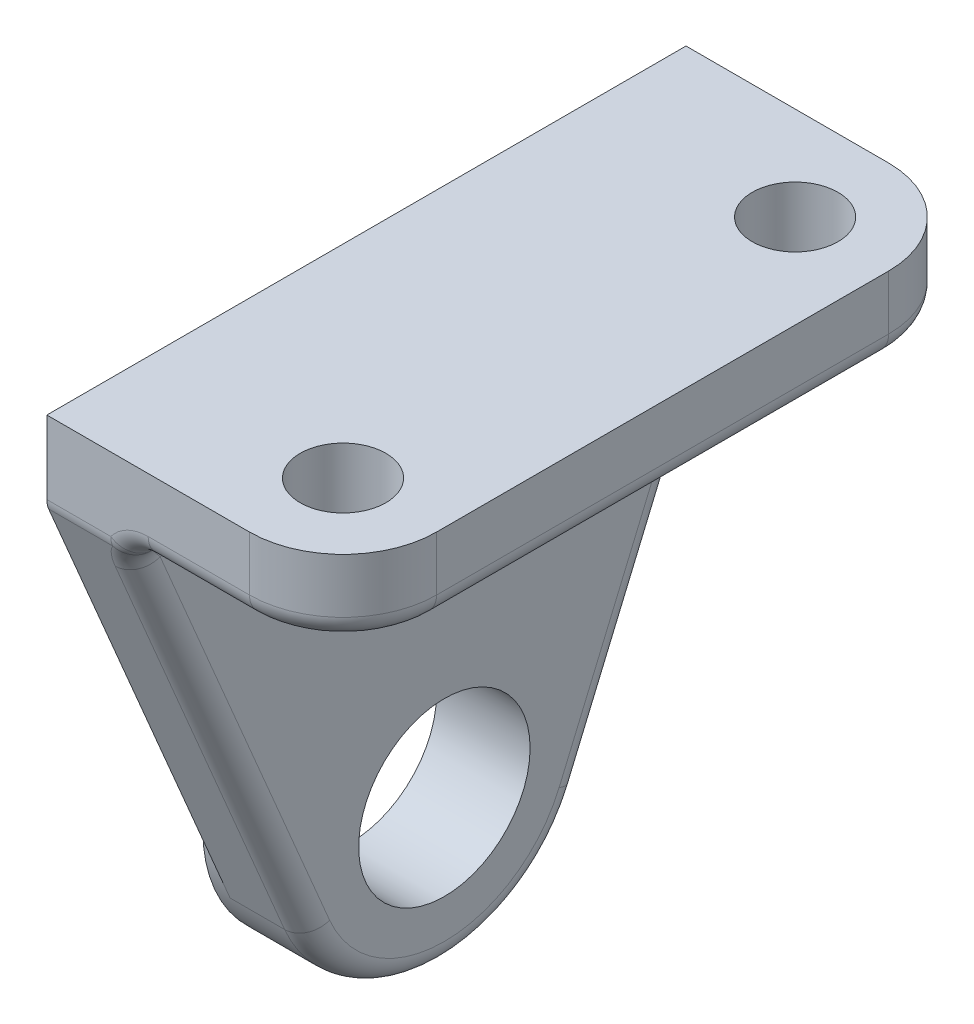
SolidWorks part; units mm, degrees
ref_plane "前基準面" through (0, 0, 0) normal (0, 0, 1) x (1, 0, 0)
ref_plane "上基準面" through (0, 0, 0) normal (0, 1, 0) x (1, 0, 0)
ref_plane "右基準面" through (0, 0, 0) normal (1, 0, 0) x (0, 0, -1)
sketch "草圖1" plane through (0, 0, 0) normal (1, 0, 0) x (0, 0, -1)
  circle A0 centre (0, 0) radius 19
  circle A1 centre (0, 0) radius 11
  dimension "D1" = 38
  dimension "D2" = 22
extrude "伸長1" add sketch "草圖1" against normal blind 12
sketch "草圖2" plane through (0, 0, 0) normal (1, 0, 0) x (0, 0, -1)
  line L0 (0, 0) -> (0, 76.0908) construction
  line L1 (-41, 48) -> (41, 48)
  line L3 (41, 48) -> (17.4914, -7.4197)
  line L4 (-41, 48) -> (-17.4914, -7.4197)
  circle A0 centre (0, 0) radius 19 construction
  arc A1 (-17.4914, -7.4197) -> (17.4914, -7.4197) centre (0, 0) ccw
  circle A2 centre (0, 0) radius 11 construction
  circle A3 centre (0, 0) radius 11
  dimension "D1" = 82
  dimension "D2" = 48
extrude "伸長2" add sketch "草圖2" against normal blind 10
sketch "草圖3" plane through (0, 48, 0) normal (0, 1, 0) x (-1, 0, 0)
  line L0 (10, -41) -> (10, 41) construction
  line L1 (10, -41) -> (10, 41)
  line L2 (10, -41) -> (0, -41) construction
  line L3 (10, -41) -> (-28, -41)
  line L4 (10, 41) -> (0, 41) construction
  line L5 (10, 41) -> (-28, 41)
  line L6 (-28, -41) -> (-28, 41)
  dimension "D1" = 38
extrude "伸長3" add sketch "草圖3" along normal blind 10
fillet "圓角1" radius 12 2 edges at (28, 53, -41) (28, 53, 41)
hole_wizard "M10 六角承窩頭蓋螺釘的柱孔1" positions "草圖6" profile "草圖5" counterbore size "M10" standard "ISO"
sketch "草圖6" plane through (0, 48, 0) normal (0, -1, 0) x (1, 0, 0)
  arc A0 (28, 29) -> (16, 41) centre (16, 29) ccw construction
  arc A1 (16, -41) -> (28, -29) centre (16, -29) ccw construction
  point P0 (16, 29)
  point P6 (16, -29)
sketch "草圖5" plane through (16, 48, 29) normal (1, 0, 0) x (0, 0, -1)
  line L0 (0, 0) -> (0, 10)
  line L1 (0, 10) -> (5.5, 10)
  line L3 (5.5, 10) -> (5.5, 2)
  line L4 (5.5, 2) -> (9, 2)
  line L5 (9, 2) -> (9, 0)
  line L7 (9, 0) -> (0, 0)
  line L11 (0, -6.35) -> (0, 107.95) construction
  dimension "貫穿孔直徑" = 11
  dimension "貫穿孔深度" = 10
  dimension "柱孔直徑" = 18
  dimension "柱孔深度" = 2
fillet "圓角10" radius 3 1 edges
fillet "圓角11" radius 3 10 edges at (0.8787, 47.1213, 40.6273) (0.8787, 47.1213, -40.6273) (0, -19, 0) (24.4853, 48, -37.4853) (28, 48, 0) (24.4853, 48, 37.4853)
fillet "圓角12" radius 3 4 edges at (-0.0811, 46.9525, -39.8618) (-0.0811, 46.9525, 39.8618)
